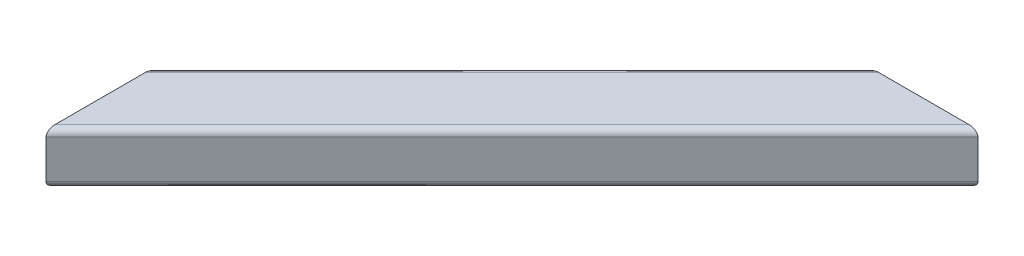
SolidWorks part; units mm, degrees
ref_plane "Płaszczyzna przednia" through (0, 0, 0) normal (0, 0, 1) x (1, 0, 0)
ref_plane "Płaszczyzna górna" through (0, 0, 0) normal (0, 1, 0) x (1, 0, 0)
ref_plane "Płaszczyzna prawa" through (0, 0, 0) normal (1, 0, 0) x (0, 0, -1)
sketch "Szkic1" plane through (0, 0, 0) normal (0, 1, 0) x (1, 0, 0)
  line L0 (758.8942, 1073.417) -> (758.8942, 1016.417) construction
  line L1 (8.8942, 1016.417) -> (8.8942, -1073.6548) construction
  line L2 (-846.1488, 1016.417) -> (846.1488, 1016.417) construction
  line L3 (758.8942, 1016.417) -> (8.8942, 266.417) construction
  dimension "D1" = 45
  dimension "D2" = 750
ref_plane "Płaszczyzna1" through (0, 0, -1016.417) normal (0, 0, 1) x (1, 0, 0)
ref_plane "Płaszczyzna2" through (8.8942, 0, 0) normal (-1, 0, 0) x (0, 0, 1)
sketch "Szkic3" plane through (0, 0, 0) normal (0, 1, 0) x (1, 0, 0)
  line L0 (874.155, 1237.7438) -> (-771.1848, -407.5961)
  line L2 (758.8942, 1016.417) -> (8.8942, 266.417) construction
  dimension "D1" = 75
other "Tube (rectangular) 120 X 80 X 5.0(1)"
ref_plane "Płaszczyzna3" through (874.155, 0, -1237.7438) normal (-0.7071, 0, 0.7071) x (0, 1, 0)
sketch "Sketch11" plane through (874.155, 0, -1237.7438) normal (-0.7071, 0, 0.7071) x (0, 1, 0)
  line L0 (-30, -55) -> (30, -55)
  line L1 (-35, -50) -> (-35, 50)
  line L2 (30, 55) -> (-30, 55)
  line L3 (35, 50) -> (35, -50)
  line L4 (-30, -60) -> (30, -60)
  line L5 (-40, -50) -> (-40, 50)
  line L6 (30, 60) -> (-30, 60)
  line L7 (40, 50) -> (40, -50)
  line L8 (-40, 0) -> (-35, 0) construction
  line L9 (-35, 0) -> (35, 0) construction
  line L10 (35, 0) -> (40, 0) construction
  line L11 (0, 60) -> (0, 55) construction
  line L12 (0, 55) -> (0, -55) construction
  line L13 (0, -55) -> (0, -60) construction
  arc A0 (40, 50) -> (30, 60) centre (30, 50) ccw
  arc A1 (30, -60) -> (40, -50) centre (30, -50) ccw
  arc A2 (-40, -50) -> (-30, -60) centre (-30, -50) ccw
  arc A3 (-30, 60) -> (-40, 50) centre (-30, 50) ccw
  arc A4 (-30, 55) -> (-35, 50) centre (-30, 50) ccw
  arc A5 (35, 50) -> (30, 55) centre (30, 50) ccw
  arc A6 (30, -55) -> (35, -50) centre (30, -50) ccw
  arc A7 (-35, -50) -> (-30, -55) centre (-30, -50) ccw
  point P6 (-40, 60)
  point P33 (-40, -60)
  point P34 (40, -60)
  point P36 (40, 60)
  point P37 (0, 0)
  dimension "D1" = 10
  dimension "Thickness" = 5
  dimension "V_leg" = 120
  dimension "H_leg" = 80
other "Przytnij/Wydłuż1"
sketch "Szkic4" plane through (0, 0, 0) normal (0, 1, 0) x (1, 0, 0)
  line L0 (487.9754, 1013.917) -> (908.8942, 1013.917)
  line L1 (11.3942, 557.3358) -> (11.3942, 66.417)
  line L2 (8.8942, 1016.417) -> (8.8942, -1073.6548) construction
  line L3 (-846.1488, 1016.417) -> (846.1488, 1016.417) construction
  dimension "D1" = 2.5
  dimension "D2" = 2.5
  dimension "D3" = 80
  dimension "D4" = 150
  dimension "D5" = 100
  dimension "D6" = 200
ref_plane "Płaszczyzna4" through (487.9754, 0, -1013.917) normal (1, 0, 0) x (0, 0, -1)
